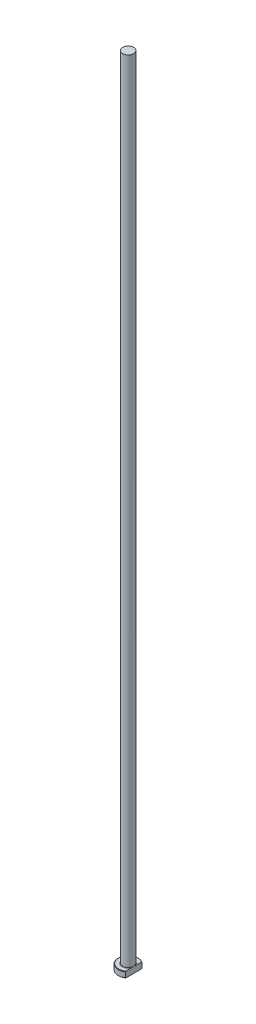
SolidWorks part; units mm, degrees
ref_plane "Front Plane" through (0, 0, 0) normal (0, 0, 1) x (1, 0, 0)
ref_plane "Top Plane" through (0, 0, 0) normal (0, 1, 0) x (1, 0, 0)
ref_plane "Right Plane" through (0, 0, 0) normal (1, 0, 0) x (0, 0, -1)
sketch "Sketch1" plane through (0, 0, 0) normal (0, 0, 1) x (1, 0, 0)
  line L0 (0, 259.9588) -> (0, -15.1925) construction
  line L1 (0, 0) -> (-5, 0)
  line L2 (-5, 0) -> (-5, 3)
  line L3 (-5, 3) -> (-2.75, 3)
  line L4 (-2.75, 3) -> (-2.75, 400)
  line L5 (-2.75, 400) -> (0, 400)
  line L6 (0, 400) -> (0, 0)
  dimension "L" = 400
  dimension "H" = 10
  dimension "T" = 3
  dimension "D" = 5.5
revolve "Revolve1" add sketch "Sketch1" angle 360 about L0
chamfer "Chamfer1" distance 0.2 angle 45 2 edges at (0, 3, 5) (0, 0, 5)
fillet "Fillet1" radius 0.2 1 edges at (0, 3, 2.75)
sketch "Sketch2" plane through (0, 0, 0) normal (0, 1, 0) x (1, 0, 0)
  line L0 (2.75, 4.1758) -> (2.75, -4.1758)
  circle A0 centre (0, 0) radius 5 construction
  arc A1 (2.75, -4.1758) -> (2.75, 4.1758) centre (0, 0) ccw
  circle A2 centre (0, 0) radius 2.75 construction
extrude "KEY" cut sketch "Sketch2" along normal through all
